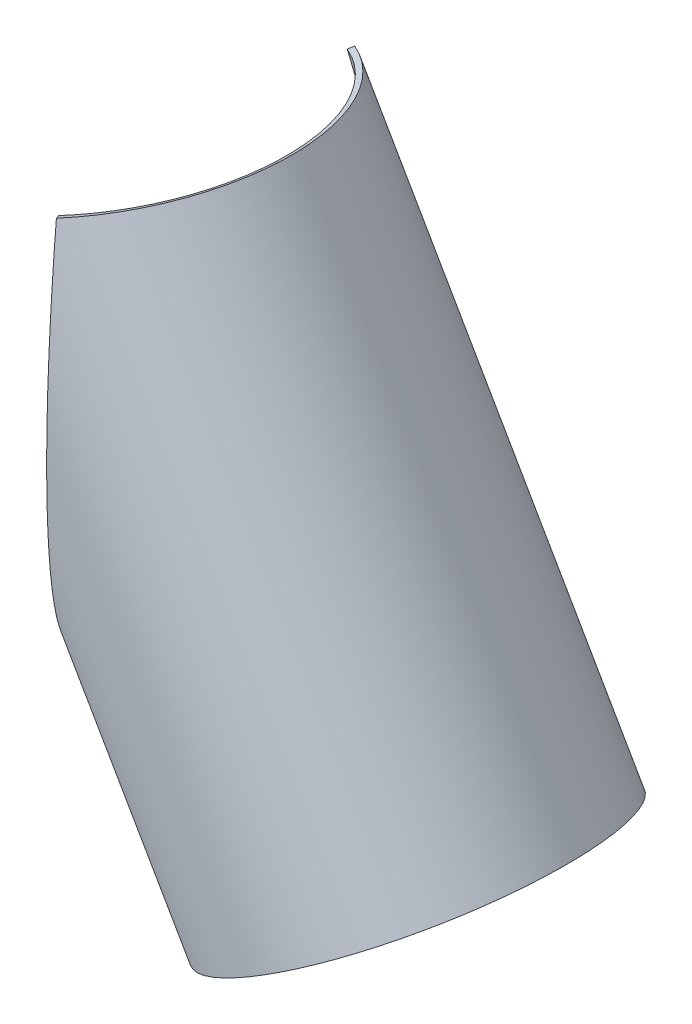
SolidWorks part; units mm, degrees
ref_plane "前视基准面" through (0, 0, 0) normal (0, 0, 1) x (1, 0, 0)
ref_plane "上视基准面" through (0, 0, 0) normal (0, 1, 0) x (1, 0, 0)
ref_plane "右视基准面" through (0, 0, 0) normal (1, 0, 0) x (0, 0, -1)
imported_body "基体零件-等径Y形四通管-1"
sheet metal parameters "钣金1" parameters "D1"=0.7366, "厚度"=6
bend "圆角折弯1" bend radius 174 bend angle 359.682 parameters "D5"=1
flatten bends "展开-折弯1"
sketch "尖角-草图1" plane through (78.0869, -495.2491, 0.5) normal (-0.866, -0.5, 0.0028) x (0.0024, 0.0014, 1)
  line L0 (546.1538, 155.5965) -> (546.1538, -155.5965) construction
  dimension "D1" = 0
process bends "加工-折弯1" parameters "D1"=0
sketch "平面-草图1" plane through (78.0869, -495.2491, 0.5) normal (-0.866, -0.5, 0.0028) x (0.0024, 0.0014, 1)
